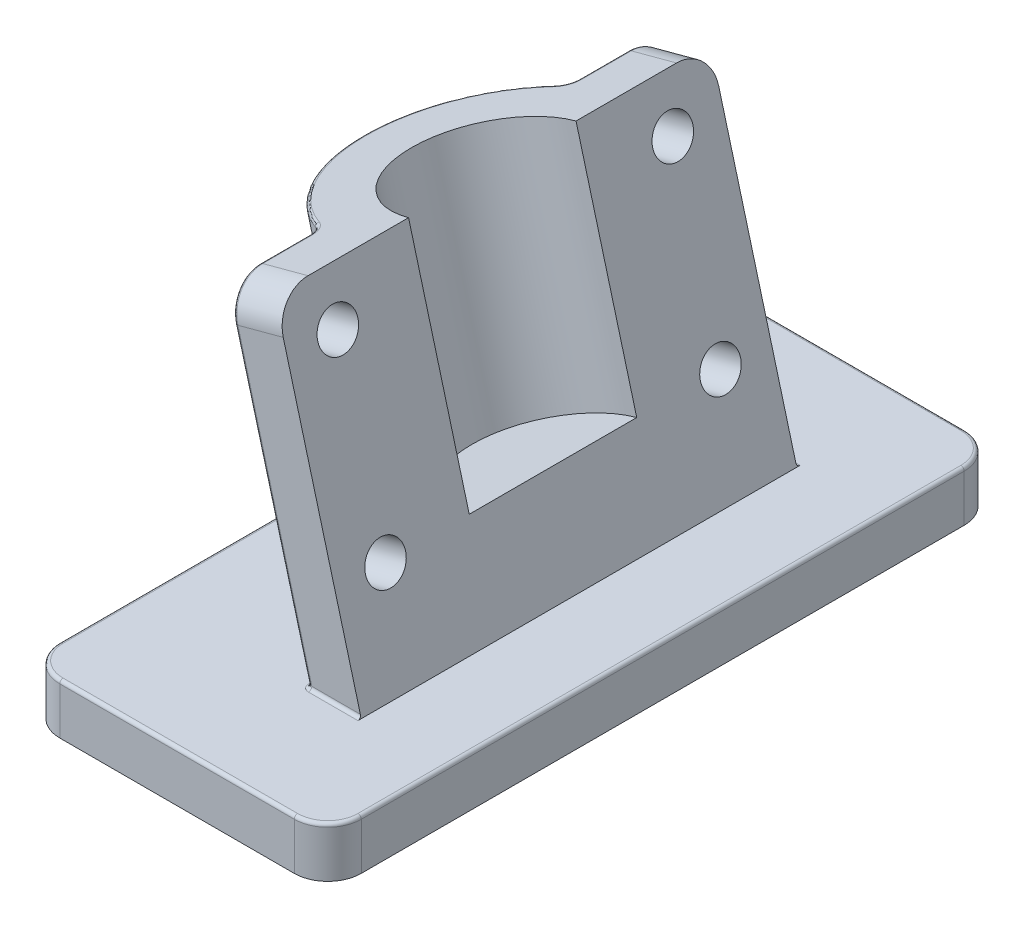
SolidWorks part; units mm, degrees
ref_plane "Front Plane" through (0, 0, 0) normal (0, 0, 1) x (1, 0, 0)
ref_plane "Top Plane" through (0, 0, 0) normal (0, 1, 0) x (1, 0, 0)
ref_plane "Right Plane" through (0, 0, 0) normal (1, 0, 0) x (0, 0, -1)
sketch "Sketch1" plane through (0, 0, 0) normal (0, 1, 0) x (1, 0, 0)
  line L1 (0, 0) -> (90, 0)
  line L2 (0, 0) -> (0, 200)
  line L3 (0, 200) -> (90, 200)
  line L4 (90, 0) -> (90, 200)
  dimension "D1" = 90
  dimension "D2" = 200
extrude "Boss-Extrude1" add sketch "Sketch1" along normal blind 15
sketch "Sketch2" plane through (0, 15, 0) normal (0, 1, 0) x (1, 0, 0)
  line L0 (0, 35) -> (90, 35) construction
  line L1 (0, 200) -> (0, 0) construction
  line L2 (65, 0) -> (65, 200) construction
  line L3 (0, 0) -> (90, 0) construction
  line L4 (90, 0) -> (90, 200) construction
  line L5 (90, 200) -> (0, 200) construction
  dimension "D1" = 35
  dimension "D2" = 25
ref_plane "Plane1" through (64.3958, 17.2548, 0) normal (0.9659, 0.2588, 0) x (0.2588, -0.9659, 0)
sketch "Sketch3" plane through (64.3958, 17.2548, 0) normal (0.9659, 0.2588, 0) x (0.2588, -0.9659, 0)
  line L0 (2.3344, 35) -> (-97.6656, 35) construction
  line L1 (-14.4889, 35) -> (8.8048, 35) construction
  line L2 (2.3344, 0) -> (2.3344, 200) construction
  dimension "D1" = 100
ref_plane "Plane2" through (39.1181, 111.5926, -35) normal (-0.2588, 0.9659, 0) x (0.9659, 0.2588, 0)
sketch "Sketch4" plane through (39.1181, 111.5926, -35) normal (-0.2588, 0.9659, 0) x (0.9659, 0.2588, 0)
  line L0 (0, 0) -> (0, 40)
  line L1 (0, 90) -> (0, 130)
  line L2 (0, -35) -> (0, 165) construction
  arc A0 (0, 90) -> (0, 40) centre (0, 65) ccw
  dimension "D2" = 25
  dimension "D1" = 130
extrude "Extrude-Thin1" add sketch "Sketch4" against normal up to next thin
fillet "Fillet1" radius 10 6 edges at (90, 7.5, 0) (90, 7.5, -200) (0, 7.5, -200) (0, 7.5, 0) (31.8737, 109.6514, -165) (31.8737, 109.6514, -35)
hole_wizard "Ø12.0 (12) Diameter Hole1" positions "Sketch6" profile "Sketch5" hole size "Ø12.0" standard "ANSI Metric"
sketch "Sketch6" plane through (64.3958, 17.2548, 0) normal (0.9659, 0.2588, 0) x (0, 0, -1)
  line L0 (125, 97.6656) -> (155, 97.6656) construction
  line L1 (100, 147.9346) -> (100, 68.8184) construction
  line L2 (100, 27.1135) -> (100, 104.1737) construction
  point P0 (50, 82.6656)
  point P2 (50, 27.6656)
  point P4 (150, 82.6656)
  point P6 (150, 27.6656)
  dimension "D1" = 15
  dimension "D2" = 55
  dimension "D3" = 100
sketch "Sketch5" plane through (43.0004, 97.1037, -50) normal (0, 0, 1) x (-0.2588, 0.9659, 0)
  line L0 (0, 0) -> (0, 66.6675)
  line L1 (0, 66.6675) -> (6, 66.6675)
  line L2 (6, 66.6675) -> (6, 0)
  line L5 (6, 0) -> (0, 0)
  line L11 (0, -6.35) -> (0, 107.95) construction
  dimension "Thru Hole Dia." = 12
  dimension "Thru Hole Depth" = 66.6675
ref_plane "Plane3" through (-7.1604, 26.723, 0) normal (-0.2588, 0.9659, 0) x (0.9659, 0.2588, 0)
sketch "Sketch7" plane through (-7.1604, 26.723, 0) normal (-0.2588, 0.9659, 0) x (0.9659, 0.2588, 0)
  line L0 (66.6675, 75) -> (66.6675, 125)
  arc A0 (66.6675, 125) -> (66.6675, 75) centre (66.6675, 100) ccw construction
  arc A1 (66.6675, 125) -> (66.6675, 75) centre (66.6675, 100) ccw
extrude "Boss-Extrude2" add sketch "Sketch7" against normal up to next
fillet "Fillet4" radius 5 2 edges at (37.05, 61.3551, -137.081) (37.05, 61.3551, -62.919)
fillet "Fillet2" radius 1 9 edges at (0.4811, 101.2398, -100) (24.6292, 107.7103, -147.6556) (25.3873, 104.8812, -162.0711) (24.6292, 107.7103, -52.3444) (25.3873, 104.8812, -37.9289) (38.3441, 56.5255, -165) (38.3441, 56.5255, -35) (23.904, 107.516, -137.6761) (23.904, 107.516, -62.3239)
fillet "Fillet3" radius 1 17 edges at (49.4709, 15, -152.1556) (23.589, 15, -100) (87.0711, 15, -197.0711) (90, 15, -100) (87.0711, 15, -2.9289) (45, 15, 0) (2.9289, 15, -2.9289) (0, 15, -100) (2.9289, 15, -197.0711) (49.4709, 15, -47.8444) (45, 15, -200) (57.7531, 15, -35) (49.7741, 15, -35.2929) (57.7531, 15, -165) (49.7741, 15, -164.7071) (48.6936, 15, -137.6761) (48.6936, 15, -62.3239)
